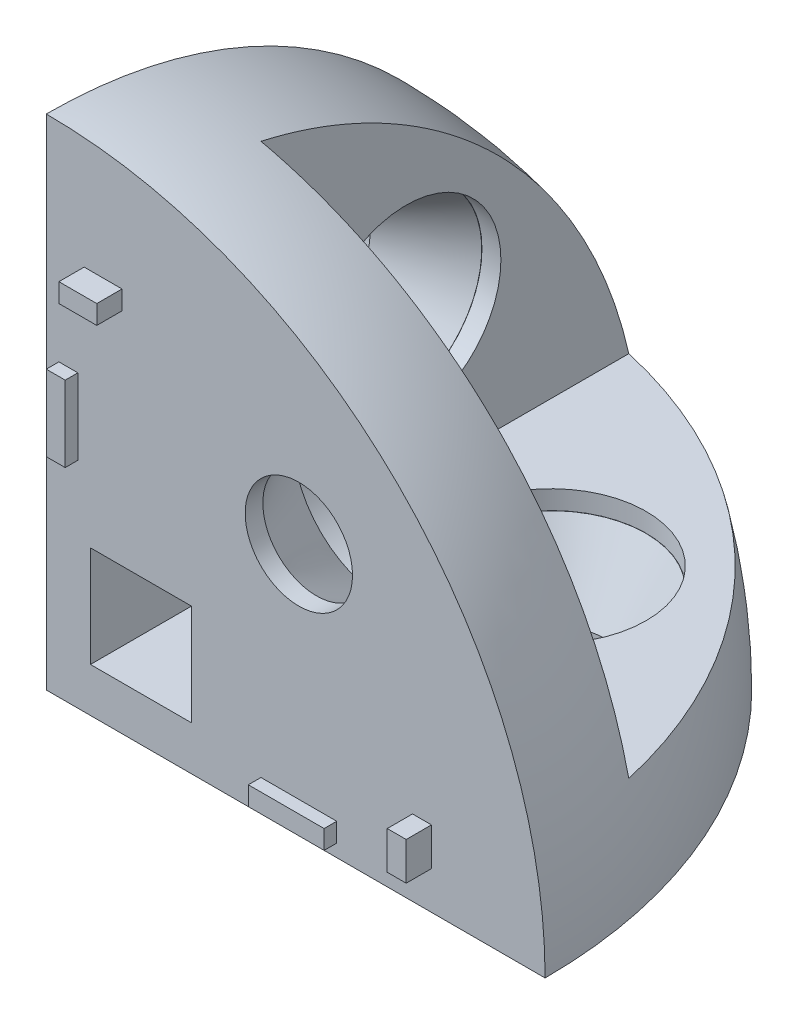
SolidWorks part; units mm, degrees
ref_plane "前视基准面" through (0, 0, 0) normal (0, 0, 1) x (1, 0, 0)
ref_plane "上视基准面" through (0, 0, 0) normal (0, 1, 0) x (1, 0, 0)
ref_plane "右视基准面" through (0, 0, 0) normal (1, 0, 0) x (0, 0, -1)
sketch "草图1" plane through (0, 0, 0) normal (0, 0, 1) x (1, 0, 0)
  line L0 (0, 0) -> (0, 39.5)
  line L1 (0, 0) -> (39.5, 0)
  arc A0 (39.5, 0) -> (0, 39.5) centre (0, 0) ccw
  dimension "D1" = 39.5
revolve "旋转2" add sketch "草图1" angle 90 about L0
ref_plane "基准面3" through (0, 0, -8.5) normal (0, 0, 1) x (1, 0, 0)
sketch "草图2" plane through (0, 0, -8.5) normal (0, 0, 1) x (1, 0, 0)
  line L0 (8.5, 38.6514) -> (8.5, 8.5)
  line L1 (8.5, 8.5) -> (40.1093, 8.5)
  line L2 (40.1093, 8.5) -> (36.6493, 40.726)
  line L3 (36.6493, 40.726) -> (8.5, 38.6514)
  line L4 (0, 39.5) -> (0, 0) construction
  line L5 (0, 0) -> (39.5, 0) construction
  dimension "D1" = 8.5
  dimension "D2" = 8.5
  dimension "D3" = 90
extrude "切除-拉伸1" cut sketch "草图2" against normal through all
sketch "草图3" plane through (0, 0, 0) normal (0, 0, 1) x (1, 0, 0)
  line L0 (0, 39.5) -> (0, 0) construction
  line L1 (0, 0) -> (39.5, 0) construction
  circle A0 centre (20, 20) radius 4.25
  dimension "D1" = 8.5
  dimension "D2" = 20
  dimension "D3" = 20
extrude "切除-拉伸2" cut sketch "草图3" against normal through all
sketch "草图5" plane through (0, 0, -8.5) normal (0, 0, 1) x (1, 0, 0)
  circle A0 centre (20, 20) radius 7.5
  dimension "D1" = 15
extrude "切除-拉伸3" cut sketch "草图5" along normal blind 1.5
ref_plane "基准面12" through (0, 0, 0) normal (-0.7071, 0, -0.7071) x (-0.7071, 0, 0.7071)
mirror "镜向3" about plane through (0, 0, 0) normal (-0.7071, 0, -0.7071) of "切除-拉伸2", "切除-拉伸3"
ref_plane "基准面13" through (0, 0, 0) normal (0, 0.7071, 0.7071) x (1, 0, 0)
mirror "镜向4" about plane through (0, 0, 0) normal (0, 0.7071, 0.7071) of "切除-拉伸2", "切除-拉伸3"
chamfer "倒角3" distance 5.6 angle 30 1 edges at (24.25, 20, -7)
chamfer "倒角4" distance 5.6 angle 30 1 edges at (20, 7, -24.25)
chamfer "倒角5" distance 5.6 angle 30 1 edges at (7, 20, -15.75)
sketch "草图18" plane through (0, 0, 0) normal (0, 0, 1) x (1, 0, 0)
  line L0 (0, 39.5) -> (0, 0) construction
  line L1 (3.5, 11.5) -> (11.5, 11.5)
  line L2 (3.5, 11.5) -> (3.5, 3.5)
  line L3 (3.5, 3.5) -> (11.5, 3.5)
  line L4 (11.5, 11.5) -> (11.5, 3.5)
  line L5 (0, 0) -> (39.5, 0) construction
  dimension "D1" = 8
  dimension "D2" = 8
  dimension "D3" = 3.5
  dimension "D4" = 3.5
extrude "切除-拉伸4" cut sketch "草图18" against normal blind 11.5
sketch "草图19" plane through (0, 0, 0) normal (0, 0, 1) x (1, 0, 0)
  line L0 (0, 39.5) -> (0, 0) construction
  line L1 (1, 23) -> (2.5, 23)
  line L2 (1, 23) -> (1, 17)
  line L3 (1, 17) -> (2.5, 17)
  line L4 (2.5, 23) -> (2.5, 17)
  line L5 (17, 1) -> (23, 1)
  line L6 (17, 1) -> (17, 2.5)
  line L7 (17, 2.5) -> (23, 2.5)
  line L8 (23, 1) -> (23, 2.5)
  line L17 (0, 0) -> (39.5, 0) construction
  dimension "D1" = 6
  dimension "D2" = 6
  dimension "D7" = 1.5
  dimension "D8" = 1.5
  dimension "D9" = 17
  dimension "D10" = 17
  dimension "D11" = 1
extrude "凸台-拉伸1" add sketch "草图19" along normal blind 1
sketch "草图21" plane through (0, 0, 0) normal (0, 0, 1) x (1, 0, 0)
  line L0 (0, 0) -> (39.5, 0) construction
  line L1 (3, 30.5) -> (6, 30.5)
  line L2 (3, 30.5) -> (3, 29)
  line L3 (3, 29) -> (6, 29)
  line L4 (6, 30.5) -> (6, 29)
  line L5 (29, 3) -> (30.5, 3)
  line L6 (29, 3) -> (29, 6)
  line L7 (29, 6) -> (30.5, 6)
  line L8 (30.5, 3) -> (30.5, 6)
  line L9 (0, 39.5) -> (0, 0) construction
  dimension "D1" = 3
  dimension "D2" = 3
  dimension "D3" = 1.5
  dimension "D4" = 1.5
  dimension "D5" = 30.5
  dimension "D6" = 30.5
  dimension "D7" = 3
  dimension "D8" = 3
extrude "凸台-拉伸2" add sketch "草图21" along normal blind 2
mirror "镜向5" about plane through (0, 0, 0) normal (0, 0.7071, 0.7071) of "凸台-拉伸1", "凸台-拉伸2"
mirror "镜向6" about plane through (0, 0, 0) normal (-0.7071, 0, -0.7071) of "凸台-拉伸1", "凸台-拉伸2"
